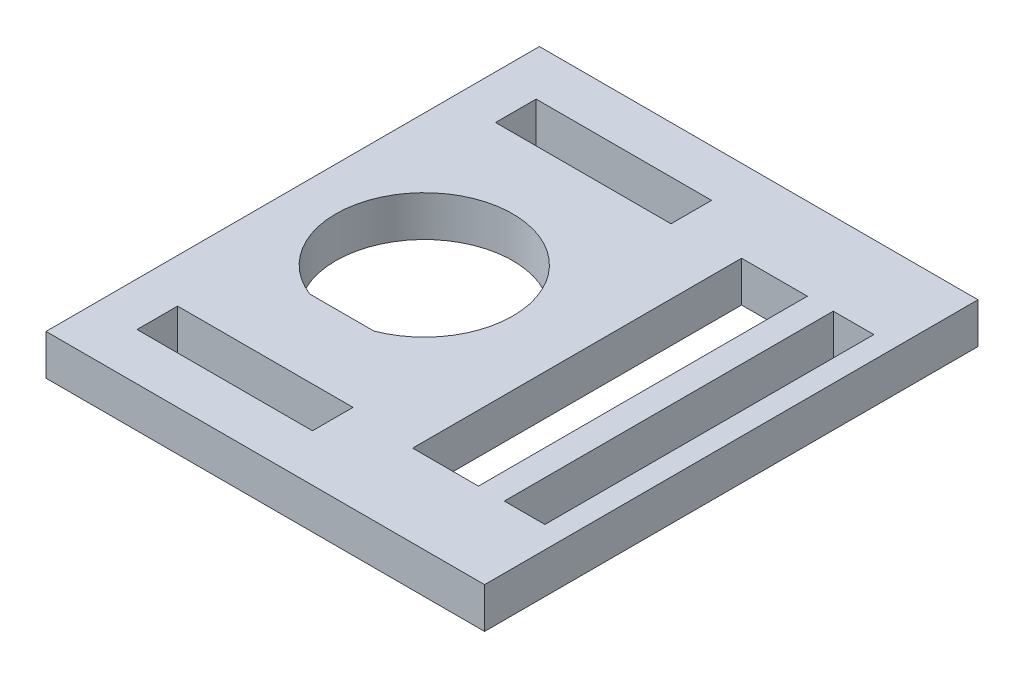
SolidWorks part; units mm, degrees
ref_plane "Front Plane" through (0, 0, 0) normal (0, 0, 1) x (1, 0, 0)
ref_plane "Top Plane" through (0, 0, 0) normal (0, 1, 0) x (1, 0, 0)
ref_plane "Right Plane" through (0, 0, 0) normal (1, 0, 0) x (0, 0, -1)
sketch "Sketch1" plane through (0, 0, 0) normal (0, 1, 0) x (1, 0, 0)
  line L1 (-25.4, 28.575) -> (25.4, 28.575)
  line L2 (-25.4, 28.575) -> (-25.4, -28.575)
  line L3 (-25.4, -28.575) -> (25.4, -28.575)
  line L4 (25.4, 28.575) -> (25.4, -28.575)
  line L5 (-25.4, 28.575) -> (25.4, -28.575) construction
  line L6 (-25.4, -28.575) -> (25.4, 28.575) construction
  point P0 (0, 0)
  dimension "D1" = 50.8
  dimension "D2" = 57.15
extrude "Boss-Extrude1" add sketch "Sketch1" along normal mid plane 4.699
sketch "Sketch4" plane through (0, 2.3495, 0) normal (0, 1, 0) x (1, 0, 0)
  line L0 (-13.8829, -9.55) -> (-6.4371, -9.55) construction
  line L1 (-13.8829, -9.55) -> (-6.4371, -9.55)
  arc A0 (-6.4371, -9.55) -> (-13.8829, -9.55) centre (-10.16, 0) ccw construction
  arc A1 (-6.4371, -9.55) -> (-13.8829, -9.55) centre (-10.16, 0) ccw
extrude "Cut-Extrude3" cut sketch "Sketch4" against normal through all
sketch "Sketch5" plane through (0, -2.3495, 0) normal (0, -1, 0) x (1, 0, 0)
  line L1 (22.86, 19.05) -> (18.161, 19.05)
  line L2 (22.86, 19.05) -> (22.86, -19.05)
  line L3 (22.86, -19.05) -> (18.161, -19.05)
  line L4 (18.161, 19.05) -> (18.161, -19.05)
  line L5 (22.86, 19.05) -> (18.161, -19.05) construction
  line L6 (22.86, -19.05) -> (18.161, 19.05) construction
  point P0 (20.5105, 0)
extrude "Cut-Extrude4" cut sketch "Sketch5" against normal through all
sketch "Sketch6" plane through (0, 2.3495, 0) normal (0, 1, 0) x (1, 0, 0)
  line L0 (18.161, -19.05) -> (18.161, 19.05) construction
  line L1 (7.541, 19.05) -> (15.161, 19.05)
  line L2 (7.541, 19.05) -> (7.541, -19.05)
  line L3 (7.541, -19.05) -> (15.161, -19.05)
  line L4 (15.161, 19.05) -> (15.161, -19.05)
  line L5 (7.541, 19.05) -> (15.161, -19.05) construction
  line L6 (7.541, -19.05) -> (15.161, 19.05) construction
  point P0 (11.351, 0)
  dimension "D1" = 7.62
  dimension "D2" = 38.1
  dimension "D3" = 3
extrude "Cut-Extrude5" cut sketch "Sketch6" against normal through all
sketch "Sketch7" plane through (0, 2.3495, 0) normal (0, 1, 0) x (1, 0, 0)
  line L4 (0, 23.114) -> (-20.32, 23.114)
  line L5 (0, 18.415) -> (0, 23.114)
  line L6 (-20.32, 18.415) -> (0, 18.415)
  line L7 (-20.32, 23.114) -> (-20.32, 18.415)
  line L8 (0, 23.114) -> (-20.32, 23.114)
  line L9 (0, 18.415) -> (0, 23.114)
  line L10 (-20.32, 18.415) -> (0, 18.415)
  line L11 (-20.32, 23.114) -> (-20.32, 18.415)
  dimension "D1" = 0
extrude "Cut-Extrude6" cut sketch "Sketch7" against normal through all
mirror "Mirror1" about plane through (0, 0, 0) normal (0, 0, 1) of "Cut-Extrude6"
